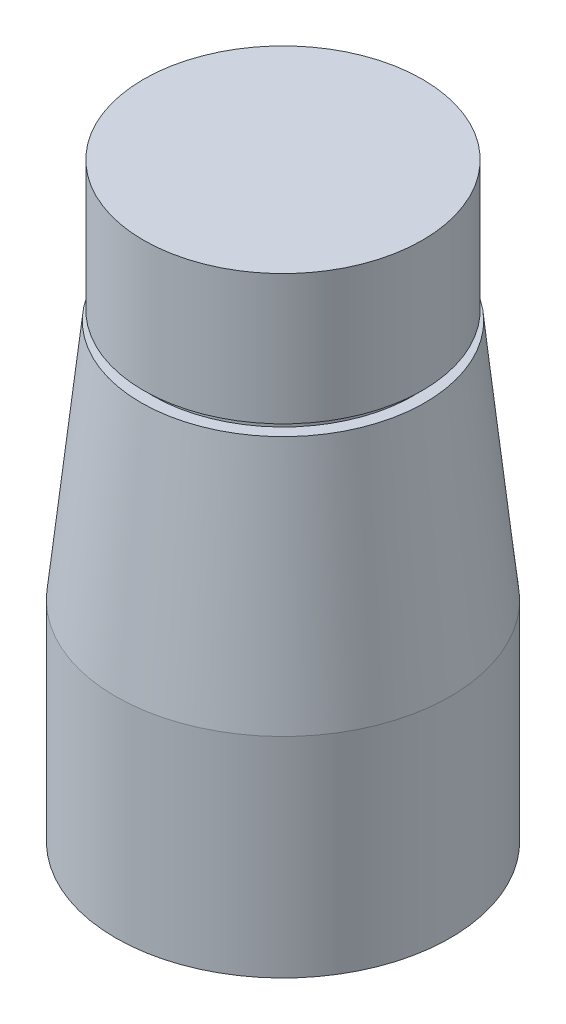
SolidWorks part; units mm, degrees
ref_plane "Front Plane" through (0, 0, 0) normal (0, 0, 1) x (1, 0, 0)
ref_plane "Top Plane" through (0, 0, 0) normal (0, 1, 0) x (1, 0, 0)
ref_plane "Right Plane" through (0, 0, 0) normal (1, 0, 0) x (0, 0, -1)
sketch "Sketch1" plane through (0, 0, 0) normal (0, 0, 1) x (1, 0, 0)
  line L0 (0, 85.1026) -> (0, 0) construction
  line L1 (0, 0) -> (-18, 0)
  line L2 (-18, 0) -> (-18, 22.5)
  line L3 (-18, 22.5) -> (-15.2673, 48.5)
  line L4 (-15.2673, 48.5) -> (-14, 48.5)
  line L5 (-14, 48.5) -> (-14, 49.5)
  line L6 (-14, 49.5) -> (-15, 49.5)
  line L7 (-15, 49.5) -> (-15, 63.5)
  line L8 (-15, 63.5) -> (0, 63.5)
  line L9 (0, 0) -> (0, 63.5)
  dimension "D1" = 63.5
  dimension "D2" = 1
  dimension "D3" = 26
  dimension "D4" = 6
  dimension "D5" = 14
  dimension "D6" = 18
  dimension "D7" = 15
  dimension "D8" = 1
revolve "Revolve1" add sketch "Sketch1" angle 360 about L0
